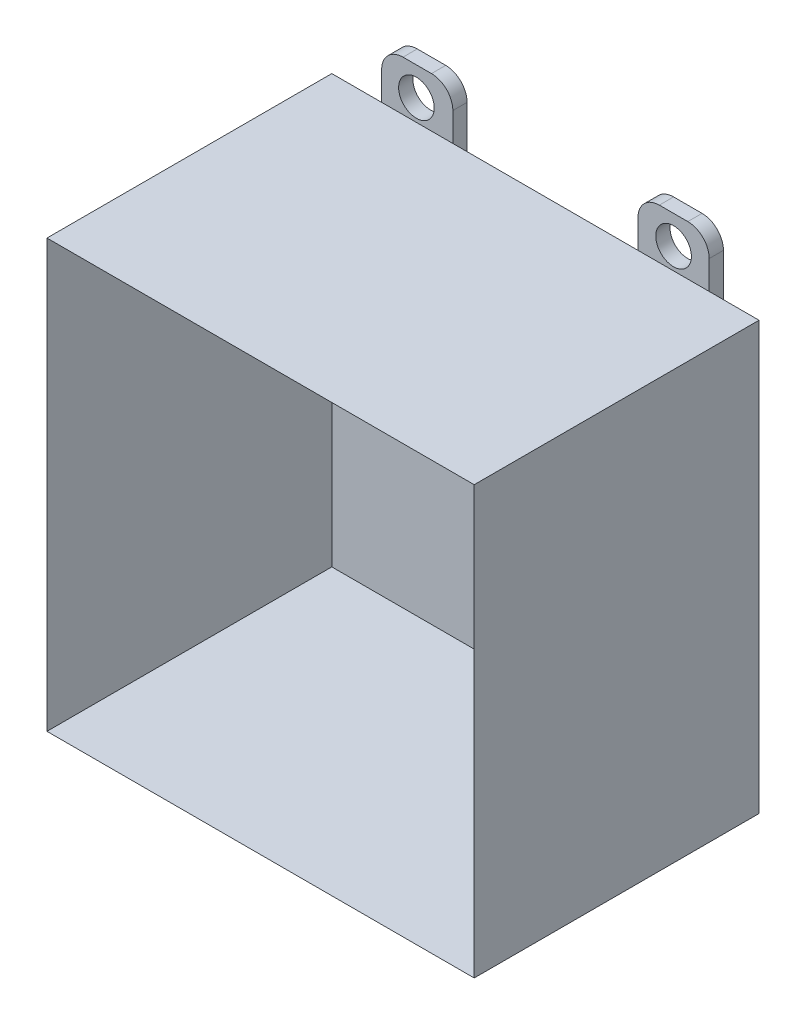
SolidWorks part; units mm, degrees
ref_plane "Front Plane" through (0, 0, 0) normal (0, 0, 1) x (1, 0, 0)
ref_plane "Top Plane" through (0, 0, 0) normal (0, 1, 0) x (1, 0, 0)
ref_plane "Right Plane" through (0, 0, 0) normal (1, 0, 0) x (0, 0, -1)
sketch "Sketch1" plane through (0, 0, 0) normal (0, 0, 1) x (1, 0, 0)
  line L1 (-38.1, -38.1) -> (38.1, -38.1)
  line L2 (-38.1, -38.1) -> (-38.1, 38.1)
  line L3 (-38.1, 38.1) -> (38.1, 38.1)
  line L4 (38.1, -38.1) -> (38.1, 38.1)
  line L5 (-38.1, -38.1) -> (38.1, 38.1) construction
  line L6 (-38.1, 38.1) -> (38.1, -38.1) construction
  point P0 (0, 0)
  dimension "D1" = 76.2
  dimension "D2" = 76.2
extrude "Boss-Extrude1" add sketch "Sketch1" along normal blind 50.8
other "DeleteFace1"
sketch "Sketch2" plane through (0, 0, 0) normal (0, 0, -1) x (-1, 0, 0)
  line L0 (-38.1, 38.1) -> (38.1, 38.1) construction
  line L1 (-29.21, 46.99) -> (-16.51, 46.99)
  line L2 (-29.21, 46.99) -> (-29.21, 29.21)
  line L3 (-29.21, 29.21) -> (-16.51, 29.21)
  line L4 (-16.51, 46.99) -> (-16.51, 29.21)
  line L5 (-29.21, 46.99) -> (-16.51, 29.21) construction
  line L6 (-29.21, 29.21) -> (-16.51, 46.99) construction
  line L8 (16.51, 29.21) -> (29.21, 29.21)
  line L9 (16.51, 29.21) -> (16.51, 46.99)
  line L10 (16.51, 46.99) -> (29.21, 46.99)
  line L11 (29.21, 29.21) -> (29.21, 46.99)
  line L12 (16.51, 29.21) -> (29.21, 46.99) construction
  line L13 (16.51, 46.99) -> (29.21, 29.21) construction
  point P0 (-22.86, 38.1)
  point P7 (22.86, 38.1)
  dimension "D1" = 12.7
  dimension "D2" = 17.78
  dimension "D3" = 15.24
  dimension "D4" = 12.7
  dimension "D5" = 17.78
  dimension "D6" = 15.24
extrude "Boss-Extrude2" add sketch "Sketch2" along normal blind 2.54
sketch "Sketch3" plane through (0, 0, 0) normal (0, 0, 1) x (1, 0, 0)
  line L0 (38.1, 38.1) -> (-38.1, 38.1) construction
  circle A0 centre (-23.0081, 41.91) radius 3.175
  circle A1 centre (22.86, 41.91) radius 3.175
  dimension "D1" = 6.35
  dimension "D2" = 6.35
  dimension "D3" = 3.81
  dimension "D4" = 3.81
extrude "Cut-Extrude1" cut sketch "Sketch3" against normal through all
fillet "Fillet1" radius 3.81 2 edges at (16.51, 46.99, -1.27) (29.21, 46.99, -1.27)
fillet "Fillet2" radius 3.81 2 edges at (-29.21, 46.99, -1.27) (-16.51, 46.99, -1.27)
